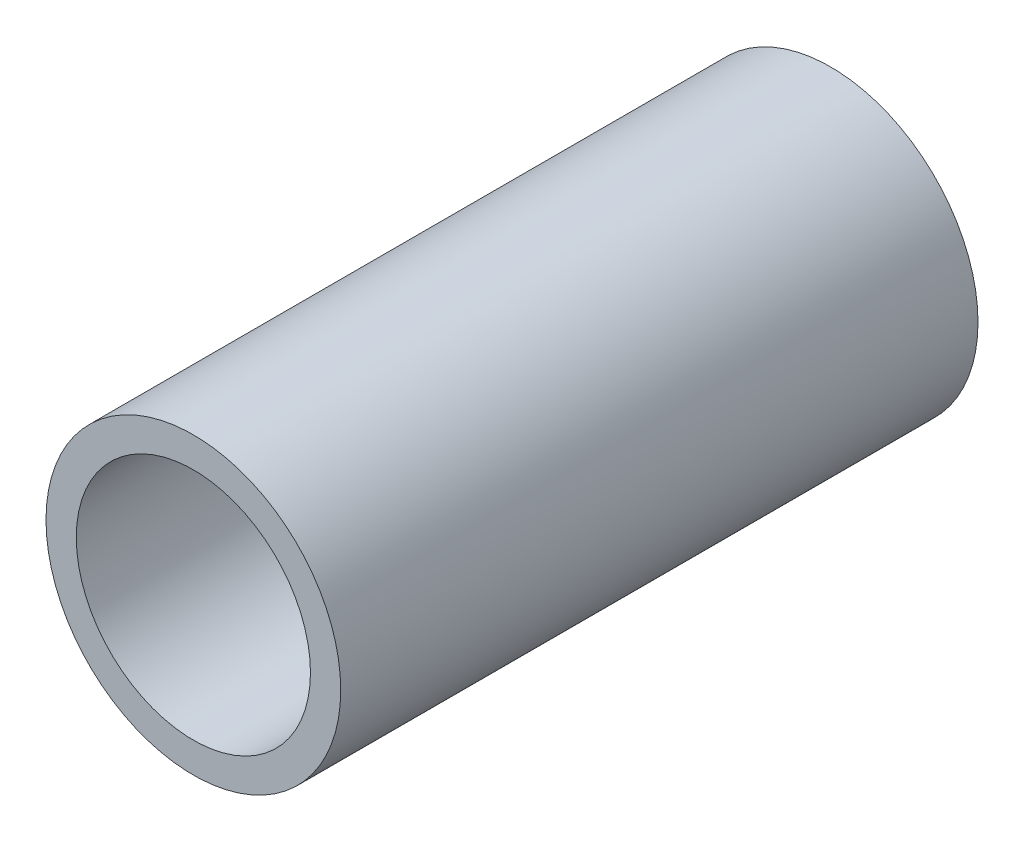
SolidWorks part; units mm, degrees
ref_plane "Front" through (0, 0, 0) normal (0, 0, 1) x (1, 0, 0)
ref_plane "Top" through (0, 0, 0) normal (0, 1, 0) x (1, 0, 0)
ref_plane "Right" through (0, 0, 0) normal (1, 0, 0) x (0, 0, -1)
sketch "Esquisse1" plane through (0, 0, 0) normal (0, 0, 1) x (1, 0, 0)
  circle A0 centre (0, 0) radius 7.35
  circle A1 centre (0, 0) radius 9.25
  dimension "D1" = 18.5
  dimension "D2" = 14.7
extrude "Boss.-Extru.1" add sketch "Esquisse1" along normal blind 40
